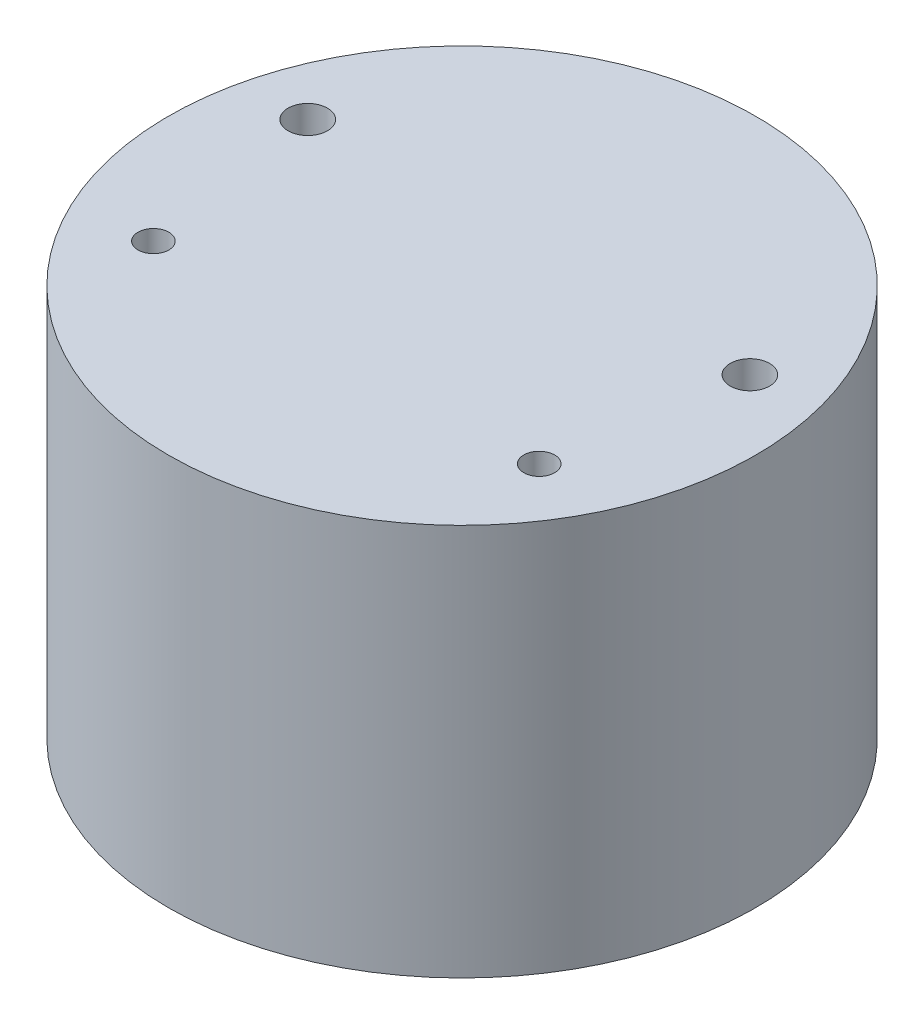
SolidWorks part; units mm, degrees
ref_plane "Front Plane" through (0, 0, 0) normal (0, 0, 1) x (1, 0, 0)
ref_plane "Top Plane" through (0, 0, 0) normal (0, 1, 0) x (1, 0, 0)
ref_plane "Right Plane" through (0, 0, 0) normal (1, 0, 0) x (0, 0, -1)
sketch "Sketch1" plane through (0, 0, 0) normal (0, 1, 0) x (1, 0, 0)
  circle A0 centre (0, 0) radius 38.05
  dimension "D1" = 76.1
extrude "Boss-Extrude1" add sketch "Sketch1" along normal blind 50.8
hole_wizard "1/4-20 Tapped Hole1" positions "Sketch3" profile "Sketch2" tap size "1/4-20" standard "Ansi Inch"
sketch "Sketch3" plane through (0, 50.8, 0) normal (0, 1, 0) x (-1, 0, 0)
  point P0 (28.65, -8.65)
  point P1 (-28.65, -8.65)
  dimension "D1" = 8.65
  dimension "D2" = 8.65
  dimension "D3" = 28.65
  dimension "D4" = 28.65
sketch "Sketch2" plane through (-28.65, 50.8, -8.65) normal (1, 0, 0) x (0, 0, 1)
  line L0 (0, 0) -> (0, 18.0438)
  line L1 (0, 18.0438) -> (2.5527, 16.51)
  line L2 (2.5527, 16.51) -> (2.5527, 0)
  line L5 (2.5527, 0) -> (0, 0)
  line L10 (0, 18.0438) -> (-2.5527, 16.51) construction
  line L11 (0, -6.35) -> (0, 107.95) construction
  dimension "Tap Drill Dia." = 5.1054
  dimension "Tap Drill Depth" = 16.51
  dimension "Drill Angle" = 118
sketch "Sketch4" plane through (0, 50.8, 0) normal (0, 1, 0) x (1, 0, 0)
  circle A0 centre (25, -15) radius 2
  circle A1 centre (-25, -15) radius 2
  dimension "D1" = 15
  dimension "D2" = 15
  dimension "D3" = 25
  dimension "D4" = 25
extrude "Cut-Extrude1" cut sketch "Sketch4" against normal blind 10
